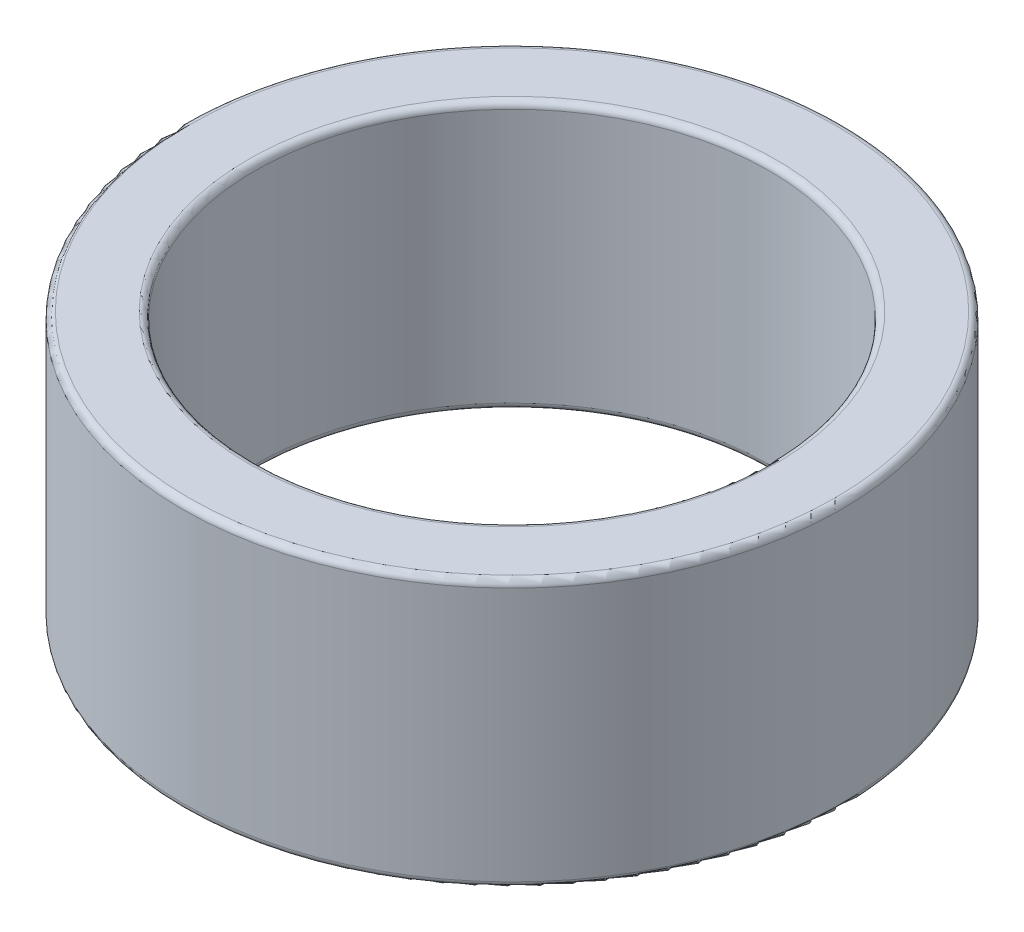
SolidWorks part; units mm, degrees
ref_plane "Front Plane" through (0, 0, 0) normal (0, 0, 1) x (1, 0, 0)
ref_plane "Top Plane" through (0, 0, 0) normal (0, 1, 0) x (1, 0, 0)
ref_plane "Right Plane" through (0, 0, 0) normal (1, 0, 0) x (0, 0, -1)
sketch "Sketch1" plane through (0, 0, 0) normal (0, 1, 0) x (1, 0, 0)
  circle A0 centre (0, 0) radius 12.7
  dimension "D1" = 25.4
extrude "Extrude1" add sketch "Sketch1" along normal blind 10.3124
sketch "Sketch2" plane through (0, 0, 0) normal (0, -1, 0) x (1, 0, 0)
  circle A0 centre (0, 0) radius 9.906
  dimension "D1" = 19.812
extrude "Cut-Extrude1" cut sketch "Sketch2" against normal through all
fillet "Fillet1" radius 0.254 4 edges at (0, 0, 12.7) (0, 0, -9.906) (0, 10.3124, -9.906) (0, 10.3124, 12.7)
